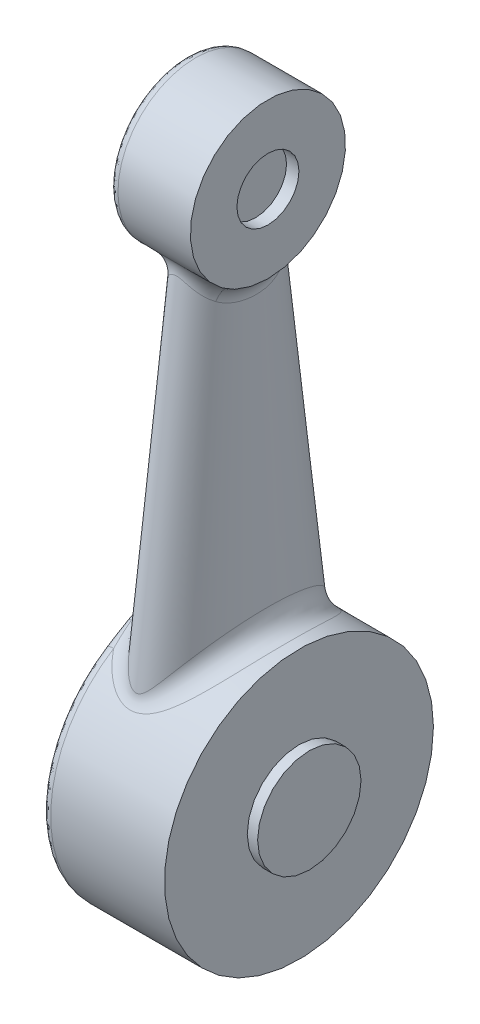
SolidWorks part; units mm, degrees
ref_plane "正面" through (0, 0, 0) normal (0, 0, 1) x (1, 0, 0)
ref_plane "平面" through (0, 0, 0) normal (0, 1, 0) x (1, 0, 0)
ref_plane "右側面" through (0, 0, 0) normal (1, 0, 0) x (0, 0, -1)
sketch "ｽｹｯﾁ1" plane through (0, 0, 0) normal (1, 0, 0) x (0, 0, -1)
  circle A0 centre (0, 0) radius 130
  dimension "D1" = 260
extrude "ﾎﾞｽ - 押し出し1" add sketch "ｽｹｯﾁ1" against normal blind 120
sketch "ｽｹｯﾁ2" plane through (0, 0, 0) normal (1, 0, 0) x (0, 0, -1)
  circle A0 centre (0, 0) radius 50
  dimension "D1" = 100
extrude "ﾎﾞｽ - 押し出し2" add sketch "ｽｹｯﾁ2" along normal blind 10
ref_plane "平面1" through (-30, 0, 0) normal (1, 0, 0) x (0, 0, -1)
sketch "ｽｹｯﾁ3" plane through (-30, 0, 0) normal (1, 0, 0) x (0, 0, -1)
  circle A0 centre (0, 500) radius 75
  dimension "D1" = 150
  dimension "D2" = 500
extrude "ﾎﾞｽ - 押し出し3" add sketch "ｽｹｯﾁ3" against normal blind 80 separate body
sketch "ｽｹｯﾁ4" plane through (-30, 0, 0) normal (1, 0, 0) x (0, 0, -1)
  circle A0 centre (0, 500) radius 30
  circle A1 centre (0, 500) radius 75 construction
  dimension "D1" = 60
extrude "ｶｯﾄ - 押し出し1" cut sketch "ｽｹｯﾁ4" against normal blind 12
sketch "ｽｹｯﾁ5" plane through (0, 0, 0) normal (0, 1, 0) x (1, 0, 0)
  ellipse E0 centre (-70, 0) end of major axis (-70, 100) minor radius 45
  dimension "D1" = 70
  dimension "D2" = 200
  dimension "D3" = 90
ref_plane "平面2" through (0, 500, 0) normal (0, 1, 0) x (1, 0, 0)
sketch "ｽｹｯﾁ6" plane through (0, 500, 0) normal (0, 1, 0) x (1, 0, 0)
  ellipse E0 centre (-70, 0) end of major axis (-70, 40) minor radius 25
  dimension "D1" = 70
  dimension "D2" = 80
  dimension "D3" = 50
loft "ﾛﾌﾄ1" add profiles "ｽｹｯﾁ5", "ｽｹｯﾁ6"
fillet "ﾌｨﾚｯﾄ1" radius 20 2 edges at (-74.0052, 441.1986, -46.5553) (-72.4468, 95.3166, -88.4011)
fillet "ﾌｨﾚｯﾄ2" radius 10 4 edges at (-120, 129.9999, -0.1801) (-110, 425.0001, -0.1427) (-120, -129.9999, 0.1801) (-110, 574.9999, 0.1427)
